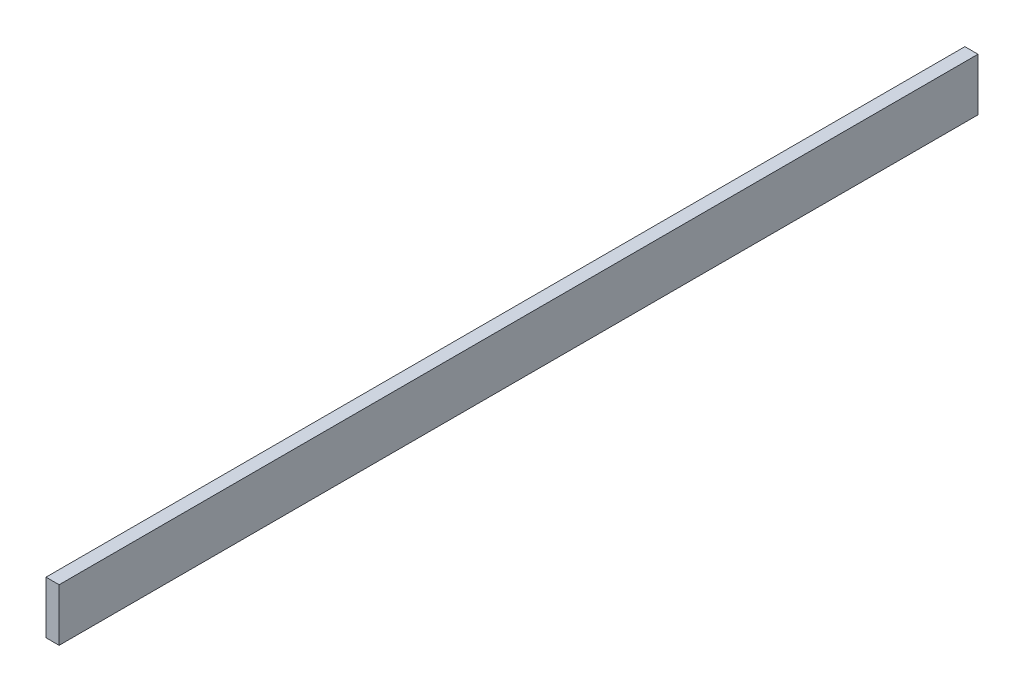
SolidWorks part; units mm, degrees
ref_plane "Plan de face" through (0, 0, 0) normal (0, 0, 1) x (1, 0, 0)
ref_plane "Plan de dessus" through (0, 0, 0) normal (0, 1, 0) x (1, 0, 0)
ref_plane "Plan de droite" through (0, 0, 0) normal (1, 0, 0) x (0, 0, -1)
sketch "Esquisse1" plane through (0, 0, 0) normal (0, 0, 1) x (1, 0, 0)
  line L1 (-2.5, 20) -> (2.5, 20)
  line L2 (-2.5, 20) -> (-2.5, 0)
  line L3 (-2.5, 0) -> (2.5, 0)
  line L4 (2.5, 20) -> (2.5, 0)
  dimension "D1" = 5
  dimension "D2" = 20
extrude "Extrusion1" add sketch "Esquisse1" along normal blind 350
